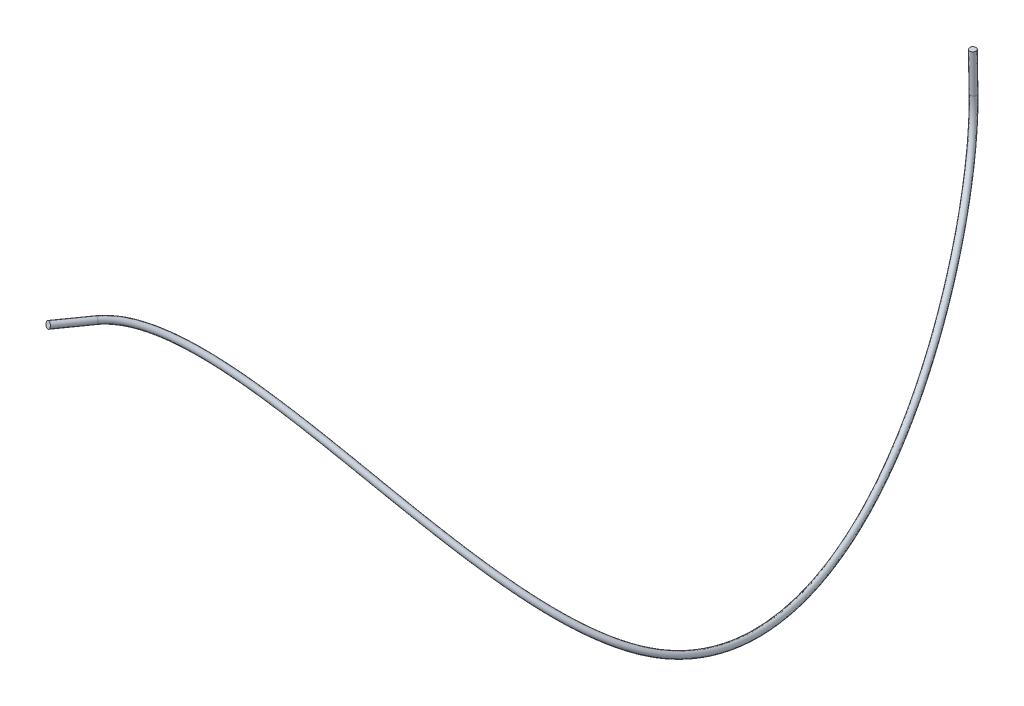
SolidWorks part; units mm, degrees
ref_plane "Front Plane" through (0, 0, 0) normal (0, 0, 1) x (1, 0, 0)
ref_plane "Top Plane" through (0, 0, 0) normal (0, 1, 0) x (1, 0, 0)
ref_plane "Right Plane" through (0, 0, 0) normal (1, 0, 0) x (0, 0, -1)
sketch3d "3DSketch1"
  line L0 (-8.5624, 140.8942, 285.4775) -> (-5.5374, 138.8135, 276.1677) construction
  line L1 (32.5019, 124.0594, 87.1142) -> (32.5019, 114.0533, 86.9395) construction
  line L2 (-8.5624, 140.8942, 285.4775) -> (-5.5374, 138.8135, 276.1677)
  line L3 (32.5019, 124.0594, 87.1142) -> (32.5019, 114.0533, 86.9395)
  spline S0 degree 3 poles (12785.7415, -5221.6293, 8237.8933) (-1648.6036, 790.0828, -500.8369) (1838.385, -524.0768, 1369.1685) (-1670.2974, 566.4864, -1419.7339) (10753.7018, 1426.5205, 11857.4622) knots -1.925649 -1.925649 -1.925649 -1.925649 0.443879 3.044019 3.044019 3.044019 3.044019 only from (-5.5374, 138.8135, 276.1677) to (32.5019, 114.0533, 86.9395) construction
  spline S1 degree 3 poles (-5.5374, 138.8135, 276.1677) (3.3384, 132.7082, 248.8506) (159.5467, 55.7661, 261.8837) (32.5019, 76.1907, 86.2786) (32.5019, 114.0533, 86.9395) knots 0 0 0 0 0.443879 1 1 1 1
ref_plane "Plane1" through (-8.5624, 140.8942, 285.4775) normal (0.3023, -0.2079, -0.9303) x (-0.9532, -0.0659, -0.295)
sketch "PipeSketch" plane through (-8.5624, 140.8942, 285.4775) normal (0.3023, -0.2079, -0.9303) x (-0.9532, -0.0659, -0.295)
  circle A0 centre (0, 0) radius 0.813
  dimension "OuterDiameter" = 1.626
sweep "Cable_1" add profiles "PipeSketch" path "3DSketch1"
